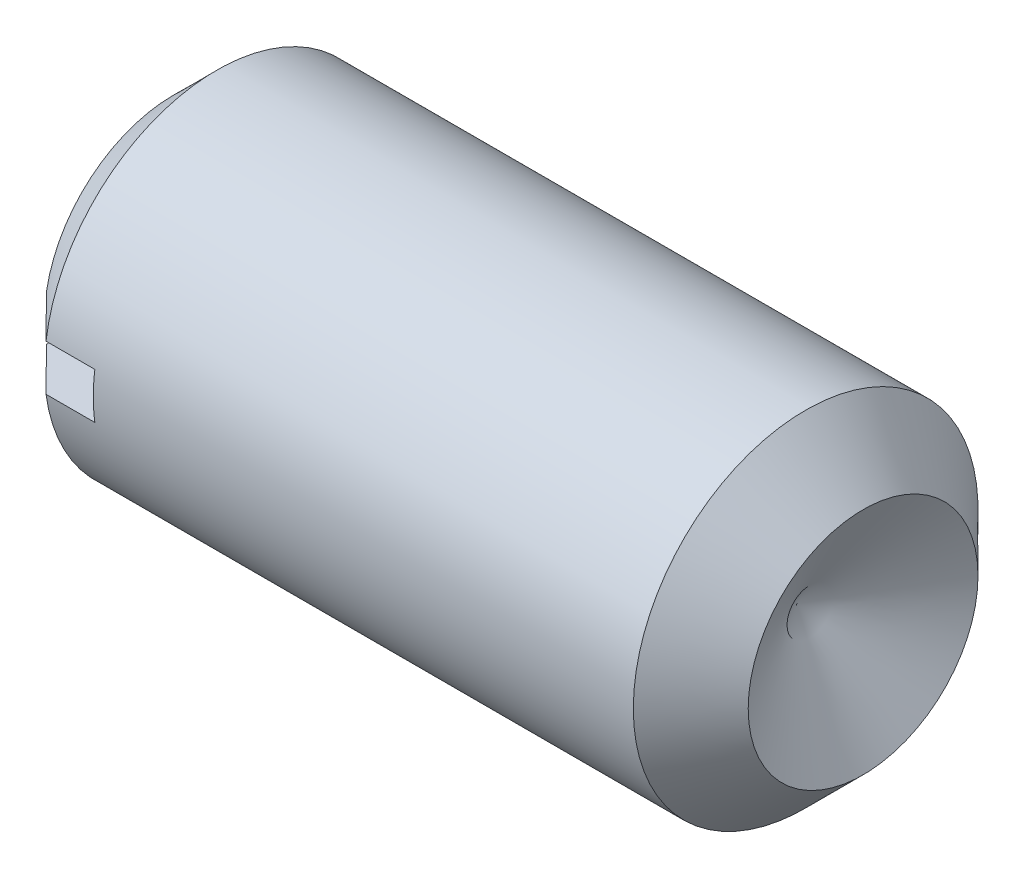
SolidWorks part; units mm, degrees
ref_plane "Front" through (0, 0, 0) normal (0, 0, 1) x (1, 0, 0)
ref_plane "Top" through (0, 0, 0) normal (0, 1, 0) x (1, 0, 0)
ref_plane "Right" through (0, 0, 0) normal (1, 0, 0) x (0, 0, -1)
other "Configuration Table"
sketch "Sketch1" plane through (0, 0, 0) normal (0, 0, 1) x (1, 0, 0)
  line L0 (0, 0) -> (5.4226, 0)
  line L2 (6, 1) -> (5.5, 1.5)
  line L3 (5.5, 1.5) -> (0.375, 1.5)
  line L4 (0.375, 1.5) -> (0, 1.125)
  line L5 (0, 1.125) -> (0, 0)
  line L6 (-10.745, 0) -> (0.8952, 0) construction
  line L7 (6, 1) -> (5.4226, 0)
revolve "Base" add sketch "Sketch1" angle 360 about L6
sketch "Sketch2" plane through (0, 0, 0) normal (0, 0, 1) x (1, 0, 0)
  line L1 (0, 0.2) -> (0.8, 0.2)
  line L2 (0, 0.2) -> (0, -0.2)
  line L3 (0, -0.2) -> (0.8, -0.2)
  line L4 (0.8, 0.2) -> (0.8, -0.2)
  line L5 (0, 1.125) -> (0, -1.125) construction
extrude "Notch" cut sketch "Sketch2" against normal through all and the other way through all
sketch "Sketch3" plane through (0, 0, 0) normal (0, 0, 1) x (1, 0, 0)
  line L0 (0.375, 1.1752) -> (0.5625, 1.5)
  line L1 (0.5625, 1.5) -> (0.5625, 1.875)
  line L2 (0.5625, 1.875) -> (0.1875, 1.875)
  line L3 (0.1875, 1.875) -> (0.1875, 1.5)
  line L4 (0.1875, 1.5) -> (0.375, 1.1752)
  line L5 (0.375, 1.5) -> (0.375, 0.2) construction
  line L6 (0, 0) -> (3.2886, 0) construction
revolve "Cut-Revolve10" [suppressed] cut sketch "Sketch3" angle 360 about L6
pattern_linear "LPattern10" [suppressed] count 13 spacing 0.45 along (1, 0, 0)
equation "\"df@Sketch1\" = \"D2@ThreadCosmetic1\""
equation "\"m@Sketch2\" = \"n@Sketch2\" / 2"
equation "\"D1@Sketch3\" = \"d@Sketch1\""
equation "\"D2@Sketch3\" =  ( \"d@Sketch1\" - \"D2@ThreadCosmetic1\" )  / 2"
equation "\"D3@LPattern10\" = \"D2@Sketch3\" * 1.2"
equation "\"D1@LPattern10\" =  ( \"l@Sketch1\" -  ( \"d@Sketch1\" - \"df@Sketch1\" )  / 2 )  / \"D3@LPattern10\""
